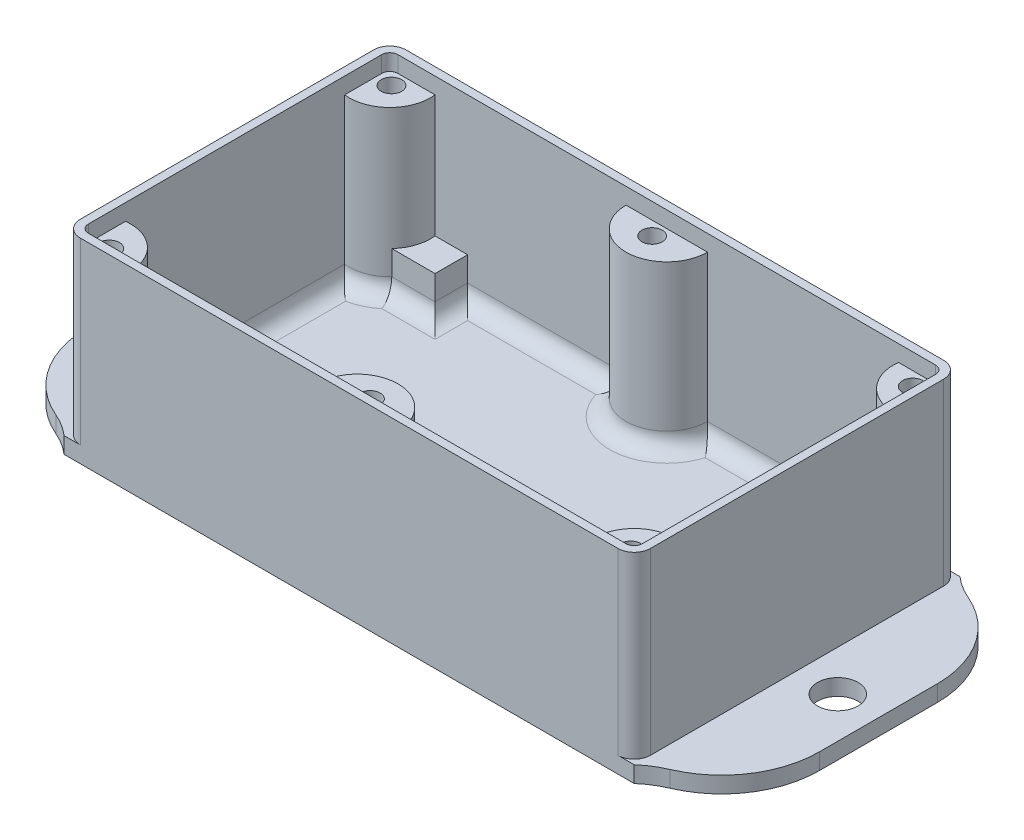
SolidWorks part; units mm, degrees
ref_plane "Front Plane" through (0, 0, 0) normal (0, 0, 1) x (1, 0, 0)
ref_plane "Top Plane" through (0, 0, 0) normal (0, 1, 0) x (1, 0, 0)
ref_plane "Right Plane" through (0, 0, 0) normal (1, 0, 0) x (0, 0, -1)
sketch "Sketch1" plane through (0, 0, 0) normal (0, 1, 0) x (1, 0, 0)
  line L0 (-35, 17.5) -> (-45, 17.5)
  line L1 (-35, -20) -> (35, -20)
  line L2 (-35, -20) -> (-35, 20)
  line L3 (-35, 20) -> (35, 20)
  line L4 (35, -20) -> (35, 20)
  line L5 (-35, -20) -> (35, 20) construction
  line L6 (-35, 20) -> (35, -20) construction
  line L7 (-45, 17.5) -> (-45, -17.5)
  line L8 (-45, -17.5) -> (-35, -17.5)
  line L9 (-57.0188, 0) -> (49.3046, 0) construction
  line L10 (0, 46.4236) -> (0, -38.5478) construction
  line L11 (45, -17.5) -> (35, -17.5)
  line L12 (35, 17.5) -> (45, 17.5)
  line L13 (45, 17.5) -> (45, -17.5)
  point P0 (0, 0)
  point P14 (-53.0925, 0)
  point P15 (47.9204, 0)
  point P16 (-57.6177, 0)
  point P17 (47.3714, 0)
  point P18 (49.3046, 0)
  point P19 (0, 39.3297)
  point P20 (0, 28.8048)
  point P21 (0, -27.6472)
  point P22 (0, 26.8911)
  point P23 (0, 29.3199)
  point P24 (0, 29.3199)
  point P25 (0, 25.7747)
  point P26 (0, 26.2474)
  point P27 (0, 27.9018)
  point P28 (0, 31.2975)
  point P29 (0, 27.3397)
  point P30 (0, 29.1286)
  point P31 (0, 28.9386)
  point P32 (0, 43.9467)
  point P33 (0, 24.9491)
  point P34 (0, 25.5191)
  point P35 (0, 25.3291)
  point P36 (0, 25.3291)
  point P37 (0, 25.899)
  point P38 (0, 39.7672)
  point P39 (0, 24.9491)
  point P40 (0, -28.434)
  point P41 (0, 26.089)
  point P42 (0, 40.1742)
  point P43 (0, -38.5478)
  point P44 (0, 41.4936)
  point P45 (0, 46.4236)
  point P46 (-57.0188, 0)
  dimension "D1" = 70
  dimension "D2" = 40
  dimension "D3" = 10
  dimension "D4" = 35
extrude "Boss-Extrude1" add sketch "Sketch1" along normal blind 2 contours L7 L8 L2 L0 | L13 L12 L4 L11
fillet "Fillet1" radius 10 4 edges at (35, 1, -17.5) (-35, 1, -17.5) (-35, 1, 17.5) (35, 1, 17.5)
sketch "Sketch2" plane through (0, 2, 0) normal (0, 1, 0) x (1, 0, 0)
  line L0 (-32, 19) -> (32, 19)
  line L1 (-33, 20) -> (33, 20)
  line L2 (-35, 18) -> (-35, -18)
  line L3 (-33, -20) -> (33, -20)
  line L4 (35, 18) -> (35, -18)
  line L5 (34, 17) -> (34, -17)
  line L6 (-32, -19) -> (32, -19)
  line L7 (-34, 17) -> (-34, -17)
  line L8 (-34, -19) -> (34, -19) construction
  line L9 (-34, 19) -> (-34, -19) construction
  line L10 (-35, 20) -> (-35, -20) construction
  line L11 (-35, -20) -> (35, -20) construction
  line L12 (34, 19) -> (34, -19) construction
  line L13 (35, 20) -> (35, -20) construction
  line L14 (-34, 19) -> (34, 19) construction
  line L15 (-35, 20) -> (35, 20) construction
  arc A0 (-32, -19) -> (-34, -17) centre (-32, -17) cw
  arc A1 (-35, -18) -> (-33, -20) centre (-33, -18) ccw
  arc A2 (34, -17) -> (32, -19) centre (32, -17) cw
  arc A3 (33, -20) -> (35, -18) centre (33, -18) ccw
  arc A4 (32, 19) -> (34, 17) centre (32, 17) cw
  arc A5 (33, 20) -> (35, 18) centre (33, 18) cw
  arc A6 (-32, 19) -> (-34, 17) centre (-32, 17) ccw
  arc A7 (-33, 20) -> (-35, 18) centre (-33, 18) ccw
  dimension "D2" = 2
  dimension "D3" = 35
  dimension "D4" = 35
  dimension "D5" = 20
  dimension "D6" = 20
  dimension "D1" = 1
extrude "Boss-Extrude2" add sketch "Sketch2" along normal blind 20
sketch "Sketch3" plane through (0, 2, 0) normal (0, 1, 0) x (1, 0, 0)
  line L0 (32, 19) -> (-32, 19) construction
  line L1 (-32, -19) -> (32, -19) construction
  line L2 (-28.4486, 19) -> (-32, 19)
  line L3 (-5, -19) -> (5, -19)
  line L4 (28.4486, -19) -> (32, -19)
  line L5 (5, 19) -> (-5, 19)
  line L6 (-32, -19) -> (32, -19)
  line L7 (-34, 17) -> (-34, -17)
  line L8 (32, 19) -> (-32, 19)
  line L9 (34, -17) -> (34, 17)
  line L10 (-32, -19) -> (-28.4486, -19)
  line L11 (-34, 17) -> (-34, 13.4486)
  line L12 (32, 19) -> (28.4486, 19)
  line L13 (34, -17) -> (34, -13.4486)
  line L14 (-34, -13.4486) -> (-34, -17)
  line L15 (34, 13.4486) -> (34, 17)
  arc A0 (-34, 13.4486) -> (-28.4486, 19) centre (-33.4142, 18.4142) ccw
  arc A1 (-32, 19) -> (-34, 17) centre (-32, 17) ccw construction
  arc A2 (28.4486, 19) -> (34, 13.4486) centre (33.4142, 18.4142) ccw
  arc A3 (34, 17) -> (32, 19) centre (32, 17) ccw construction
  arc A4 (34, -13.4486) -> (28.4486, -19) centre (33.4142, -18.4142) ccw
  arc A5 (32, -19) -> (34, -17) centre (32, -17) ccw construction
  arc A6 (-28.4486, -19) -> (-34, -13.4486) centre (-33.4142, -18.4142) ccw
  arc A7 (-34, -17) -> (-32, -19) centre (-32, -17) ccw construction
  arc A8 (-5, 19) -> (5, 19) centre (0, 19) ccw
  arc A9 (5, -19) -> (-5, -19) centre (0, -19) ccw
  arc A14 (-34, -17) -> (-32, -19) centre (-32, -17) ccw
  arc A15 (-32, 19) -> (-34, 17) centre (-32, 17) ccw
  arc A16 (34, 17) -> (32, 19) centre (32, 17) ccw
  arc A17 (32, -19) -> (34, -17) centre (32, -17) ccw
  arc A18 (-34, -17) -> (-32, -19) centre (-32, -17) ccw
  arc A19 (-32, 19) -> (-34, 17) centre (-32, 17) ccw
  arc A20 (34, 17) -> (32, 19) centre (32, 17) ccw
  arc A21 (32, -19) -> (34, -17) centre (32, -17) ccw
  dimension "D1" = 10
  dimension "D2" = 0
extrude "Boss-Extrude3" add sketch "Sketch3" along normal blind 20
sketch "Sketch4" plane through (0, 22, 0) normal (0, 1, 0) x (1, 0, 0)
  line L0 (-33, -19) -> (33, -19)
  line L1 (34, -18) -> (34, 18)
  line L2 (33, 19) -> (-33, 19)
  line L3 (-34, 18) -> (-34, -18)
  line L4 (-33, -20) -> (33, -20)
  line L5 (35, -18) -> (35, 18)
  line L6 (33, 20) -> (-33, 20)
  line L7 (-35, 18) -> (-35, -18)
  line L8 (-33, -20) -> (33, -20)
  line L9 (35, -18) -> (35, 18)
  line L10 (33, 20) -> (-33, 20)
  line L11 (-35, 18) -> (-35, -18)
  arc A0 (33, -19) -> (34, -18) centre (33, -18) ccw
  arc A1 (34, 18) -> (33, 19) centre (33, 18) ccw
  arc A2 (-33, 19) -> (-34, 18) centre (-33, 18) ccw
  arc A3 (-34, -18) -> (-33, -19) centre (-33, -18) ccw
  arc A4 (-35, -18) -> (-33, -20) centre (-33, -18) ccw
  arc A5 (33, -20) -> (35, -18) centre (33, -18) ccw
  arc A6 (35, 18) -> (33, 20) centre (33, 18) ccw
  arc A7 (-33, 20) -> (-35, 18) centre (-33, 18) ccw
  arc A8 (-35, -18) -> (-33, -20) centre (-33, -18) ccw
  arc A9 (33, -20) -> (35, -18) centre (33, -18) ccw
  arc A10 (35, 18) -> (33, 20) centre (33, 18) ccw
  arc A11 (-33, 20) -> (-35, 18) centre (-33, 18) ccw
  dimension "D1" = 0
  dimension "D2" = 1
extrude "Boss-Extrude4" add sketch "Sketch4" along normal blind 2
hole_wizard "Tap Drill for M3 Tap1" positions "3DSketch1" profile "Sketch6" hole size "M3" standard "ISO"
sketch3d "3DSketch1"
  line L1 (50.2815, 0, 0) -> (-61.0487, 0, 0) construction
  point P0 (-32.1186, 22, -17.3205)
  point P2 (-0.1186, 22, -17.3205)
  point P4 (31.8814, 22, -17.3205)
  point P6 (31.8814, 22, 17.3205)
  point P8 (-0.1186, 22, 17.3201)
  point P10 (-32.1186, 22, 17.3205)
  point P21 (0, 0, 0)
  point P22 (0, 0, 0)
  point P23 (-32.1186, 22, -17.3205)
  point P24 (0, 0, 0)
  point P25 (0, 0, 0)
  point P26 (0, 0, 0)
  dimension "D1" = 32
  dimension "D2" = 32
  dimension "D3" = 28
  dimension "D4" = 28
  dimension "D5" = 28
  dimension "D6" = 32
  dimension "D7" = 28
  dimension "D8" = 32
sketch "Sketch6" plane through (-32.1186, 22, -17.3205) normal (1, 0, 0) x (0, 0, 1)
  line L0 (0, 0) -> (0, 8.2511)
  line L1 (0, 8.2511) -> (1.25, 7.5)
  line L2 (1.25, 7.5) -> (1.25, 0)
  line L5 (1.25, 0) -> (0, 0)
  line L10 (0, 8.2511) -> (-1.25, 7.5) construction
  line L11 (0, -6.35) -> (0, 107.95) construction
  dimension "Hole Dia." = 2.5
  dimension "Hole Depth" = 7.5
  dimension "Drill Angle" = 118
sketch "Sketch7" plane through (0, 2, 0) normal (0, 1, 0) x (1, 0, 0)
  line L1 (-28.4486, 19) -> (-24.4486, 19)
  line L2 (-28.4486, 19) -> (-28.4486, 17.8284)
  line L3 (-29.7614, 15) -> (-24.4486, 15)
  line L4 (-24.4486, 19) -> (-24.4486, 15)
  line L5 (-28.4486, -19) -> (-24.4486, -19)
  line L6 (-28.4486, -19) -> (-28.4486, -17.8284)
  line L7 (-29.7614, -15) -> (-24.4486, -15)
  line L8 (-24.4486, -19) -> (-24.4486, -15)
  arc A0 (-34, 13.4486) -> (-28.4486, 19) centre (-33.4142, 18.4142) ccw construction
  arc A1 (-29.7614, 15) -> (-28.4486, 17.8284) centre (-33.4142, 18.4142) ccw
  arc A2 (-28.4486, -19) -> (-34, -13.4486) centre (-33.4142, -18.4142) ccw construction
  arc A3 (-28.4486, -17.8284) -> (-29.7614, -15) centre (-33.4142, -18.4142) ccw
  dimension "D1" = 4
  dimension "D2" = 4
  dimension "D4" = 4
extrude "Boss-Extrude5" add sketch "Sketch7" along normal blind 5
fillet "Fillet2" [suppressed] radius 2
mirror "Mirror1" about plane through (0, 0, 0) normal (1, 0, 0) of "Boss-Extrude5", "Fillet2"
fillet "Fillet4" radius 2 20 edges at (-31.6957, 2, 13.7188) (-14.7243, 2, 19) (0, 2, 14) (14.7243, 2, 19) (31.6957, 2, 13.7188) (34, 2, 0) (31.6957, 2, -13.7188) (14.7243, 2, -19) (0, 2, -14) (-31.6957, 2, -13.7188) (-34, 2, 0) (-14.7243, 2, -19) (24.4486, 2, 17) (-24.4486, 2, 17) (-27.105, 2, 15) (-27.105, 2, -15) (-24.4486, 2, -17) (24.4486, 2, -17) (27.105, 2, -15) (27.105, 2, 15)
fillet "Fillet5" radius 12 4 edges at (45, 1, -17.5) (45, 1, 17.5) (-45, 1, -17.5) (-45, 1, 17.5)
sketch "Sketch9" plane through (0, 2, 0) normal (0, 1, 0) x (1, 0, 0)
  line L0 (-53.6179, 0) -> (62.8265, 0) construction
  circle A0 centre (-40, 0) radius 2.5
  dimension "D1" = 5
  dimension "D2" = 40
extrude "Cut-Extrude1" cut sketch "Sketch9" against normal up to next
mirror "Mirror2" about plane through (0, 0, 0) normal (1, 0, 0) of "Cut-Extrude1"
